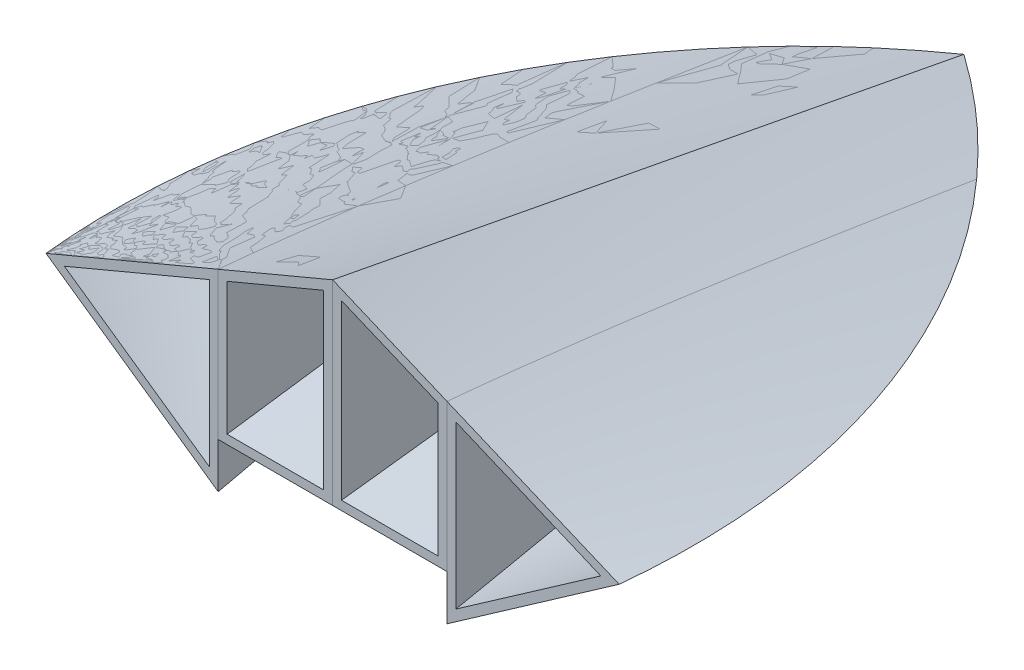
SolidWorks part; units mm, degrees
ref_plane "Ebene vorne" through (0, 0, 0) normal (0, 0, 1) x (1, 0, 0)
ref_plane "Ebene oben" through (0, 0, 0) normal (0, 1, 0) x (1, 0, 0)
ref_plane "Ebene rechts" through (0, 0, 0) normal (1, 0, 0) x (0, 0, -1)
sketch "Skizze1" plane through (0, 0, 0) normal (0, 0, 1) x (1, 0, 0)
  line L0 (0, 26.9971) -> (-64.2741, 0)
  line L2 (-64.2741, 0) -> (-25.658, -26.9891)
  line L4 (-25.658, -26.9891) -> (-25.658, -16.8383)
  line L5 (-25.658, -16.8383) -> (0, -16.8383)
sketch "Skizze2" plane through (0, 0, 0) normal (1, 0, 0) x (0, 0, -1)
  line L0 (0, 26.9971) -> (141.5806, 0)
sketch "Skizze3" plane through (0, 0, 0) normal (0, 1, 0) x (1, 0, 0)
  line L0 (0, 0) -> (0, 141.5806) construction
  arc A0 (-64.2741, 0) -> (0, 141.5806) centre (88.6698, 15.9469) cw
sketch "Skizze5" plane through (0, 0, 0) normal (0, 0, 1) x (1, 0, 0)
  line L0 (0, 26.9971) -> (-64.2741, 0) construction
  line L1 (0, 26.9971) -> (-64.2741, 0)
surface "Oberfläche-Ausformung1"
sketch "Skizze6" plane through (0, 0, 0) normal (0, 0, 1) x (1, 0, 0)
  line L0 (-25.658, -26.9891) -> (-25.658, -16.8383) construction
  line L1 (-25.658, -26.9891) -> (-25.658, 24.9515)
surface "Oberfläche-Linear austragen1" sketch "Skizze6" parameters "D1"=136
sketch "Skizze7" plane through (-25.658, 0, 0) normal (-1, 0, 0) x (0, 0, 1)
  line L1 (-118.7871, 0) -> (0, -26.9891)
  point P3 (0, 16.22)
other "Fläche löschen1"
sketch3d "3D-Skizze3"
  point P0 (-25.658, 0, -118.7871)
  point P2 (-64.2741, 0, 0)
  point P3 (0, 0, -141.5806)
surface "Oberfläche-Ausformung2"
sketch "Skizze8" plane through (0, 0, 0) normal (0, 0, 1) x (1, 0, 0)
  line L0 (0, 26.9971) -> (-64.2741, 0) construction
  line L1 (-25.658, 16.22) -> (-64.2741, 0)
  line L2 (-25.658, -26.9891) -> (-25.658, 16.22) construction
  line L3 (-25.658, -26.9891) -> (-25.658, 16.22)
  line L4 (-64.2741, 0) -> (-25.658, -26.9891) construction
  line L5 (-64.2741, 0) -> (-25.658, -26.9891)
surface "Oberfläche-Ebene1" sketch "Skizze8"
sketch "Skizze9" plane through (0, 0, 0) normal (0, 1, 0) x (1, 0, 0)
  line L0 (-25.658, 0) -> (-25.658, 118.7871) construction
  line L1 (-25.658, 0) -> (-25.658, 118.7871)
surface "Oberfläche-Zusammenfügen1"
sketch3d "3D-Skizze4"
  line L0 (0, -16.8383, 0) -> (0, 0, -141.5806)
sketch "Skizze10" plane through (-25.658, 0, 0) normal (1, 0, 0) x (0, 0, -1)
  line L0 (0, -16.8383) -> (118.7871, 0)
surface "Oberfläche-Ausformung3"
surface "Oberfläche-Ausformung4"
sketch3d "3D-Skizze5"
  point P0 (-25.658, 0, -118.7871)
  point P1 (0, 0, -141.5806)
sketch "Skizze11" plane through (0, 0, 0) normal (0, 0, 1) x (1, 0, 0)
  line L0 (-25.658, -16.8383) -> (0, -16.8383) construction
  line L1 (-25.658, -16.8383) -> (0, -16.8383)
surface "Oberfläche-Ausformung5"
surface "Oberflächenausfüllung1"
surface "Oberfläche-Zusammenfügen2"
shell "Wandung1" thickness 2
shell "Wandung2" thickness 2
mirror "Spiegeln1" about plane through (0, 0, 0) normal (1, 0, 0)
